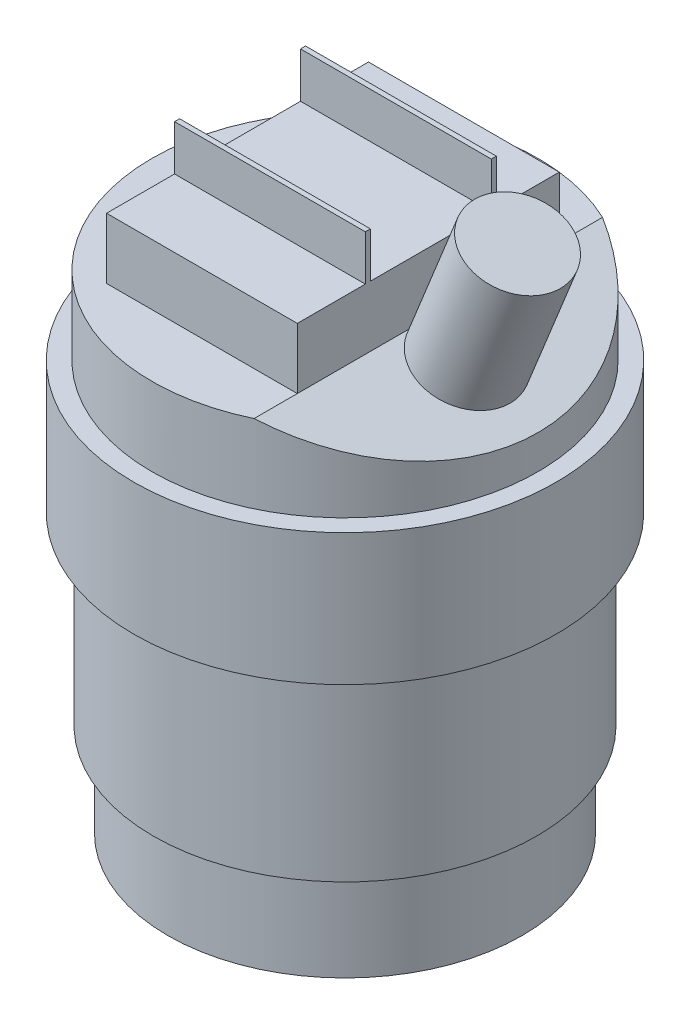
SolidWorks part; units mm, degrees
ref_plane "Front Plane" through (0, 0, 0) normal (0, 0, 1) x (1, 0, 0)
ref_plane "Top Plane" through (0, 0, 0) normal (0, 1, 0) x (1, 0, 0)
ref_plane "Right Plane" through (0, 0, 0) normal (1, 0, 0) x (0, 0, -1)
sketch "Sketch1" plane through (0, 0, 0) normal (0, 1, 0) x (1, 0, 0)
  circle A0 centre (0, 0) radius 13.3985
  dimension "D1" = 26.797
extrude "Extrude1" add sketch "Sketch1" along normal blind 7.0612
sketch "Sketch2" plane through (0, 7.0612, 0) normal (0, 1, 0) x (1, 0, 0)
  circle A0 centre (0, 0) radius 14.4907
  dimension "D1" = 28.9814
extrude "Extrude2" add sketch "Sketch2" along normal blind 13.97
sketch "Sketch3" plane through (0, 21.0312, 0) normal (0, 1, 0) x (1, 0, 0)
  circle A0 centre (0, 0) radius 15.9766
  dimension "D1" = 31.9532
extrude "Extrude3" add sketch "Sketch3" along normal blind 9.9568
sketch "Sketch4" plane through (0, 30.988, 0) normal (0, 1, 0) x (1, 0, 0)
  circle A0 centre (0, 0) radius 14.605
  dimension "D1" = 29.21
extrude "Extrude4" add sketch "Sketch4" along normal blind 5.9182
sketch "Sketch5" plane through (0, 0, 0) normal (0, 0, 1) x (1, 0, 0)
  line L0 (6.2992, 36.9062) -> (14.605, 33.5504)
  line L1 (14.605, 36.9062) -> (-14.605, 36.9062) construction
  line L2 (14.605, 30.988) -> (14.605, 36.9062) construction
  line L3 (14.605, 33.5504) -> (14.605, 36.9062)
  line L4 (14.605, 36.9062) -> (6.2992, 36.9062)
  dimension "D1" = 8.3058
  dimension "D2" = 22
extrude "Cut-Extrude1" cut sketch "Sketch5" against normal through all and the other way through all
sketch "Sketch6" plane through (0, 36.9062, 0) normal (0, 1, 0) x (1, 0, 0)
  line L0 (6.2992, 13.1767) -> (6.2992, -13.1767) construction
  line L1 (6.2992, -9.906) -> (-8.128, -9.906)
  line L2 (6.2992, -9.906) -> (6.2992, 9.906)
  line L3 (6.2992, 9.906) -> (-8.128, 9.906)
  line L4 (-8.128, -9.906) -> (-8.128, 9.906)
  line L5 (0, 14.605) -> (0, 9.906) construction
  line L7 (0, -14.605) -> (0, -9.906) construction
  circle A0 centre (0, 0) radius 14.605 construction
  arc A1 (6.2992, 13.1767) -> (6.2992, -13.1767) centre (0, 0) ccw construction
  dimension "D1" = 19.812
  dimension "D2" = 14.4272
extrude "Extrude5" add sketch "Sketch6" along normal blind 4.5974
sketch "Sketch7" plane through (0, 41.5036, 0) normal (0, 1, 0) x (1, 0, 0)
  line L0 (-8.128, 9.906) -> (-8.128, -9.906) construction
  line L1 (-8.128, 4.7625) -> (6.2992, 4.7625)
  line L2 (-8.128, 4.7625) -> (-8.128, 5.1435)
  line L3 (-8.128, 5.1435) -> (6.2992, 5.1435)
  line L4 (6.2992, 4.7625) -> (6.2992, 5.1435)
  line L5 (6.2992, -9.906) -> (6.2992, 9.906) construction
  line L6 (6.2992, -9.906) -> (6.2992, 9.906) construction
  line L7 (-8.128, -4.3815) -> (6.2992, -4.3815)
  line L8 (-8.128, -4.3815) -> (-8.128, -4.7625)
  line L9 (-8.128, -4.7625) -> (6.2992, -4.7625)
  line L10 (6.2992, -4.3815) -> (6.2992, -4.7625)
  line L11 (-0.9144, 4.7625) -> (-0.9144, 9.906) construction
  line L12 (6.2992, 9.906) -> (-8.128, 9.906) construction
  line L13 (-0.9144, -4.7625) -> (-0.9144, -9.906) construction
  line L14 (-8.128, -9.906) -> (6.2992, -9.906) construction
  dimension "D1" = 0.381
  dimension "D2" = 9.144
extrude "Extrude6" add sketch "Sketch7" along normal blind 3.429
sketch "Sketch8" plane through (13.7026, 33.915, 0) normal (0.3746, 0.9272, 0) x (0.9272, -0.3746, 0)
  line L0 (-6.0798, 0) -> (-7.9848, 0) construction
  line L1 (-7.9848, -9.906) -> (-7.9848, 9.906) construction
  circle A0 centre (-4.8098, 0) radius 1.27 construction
  circle A1 centre (-4.8098, 0) radius 3.4925
  dimension "D2" = 2.54
  dimension "D3" = 6.985
  dimension "D1" = 1.905
extrude "Extrude7" add sketch "Sketch8" along normal blind 10.16
